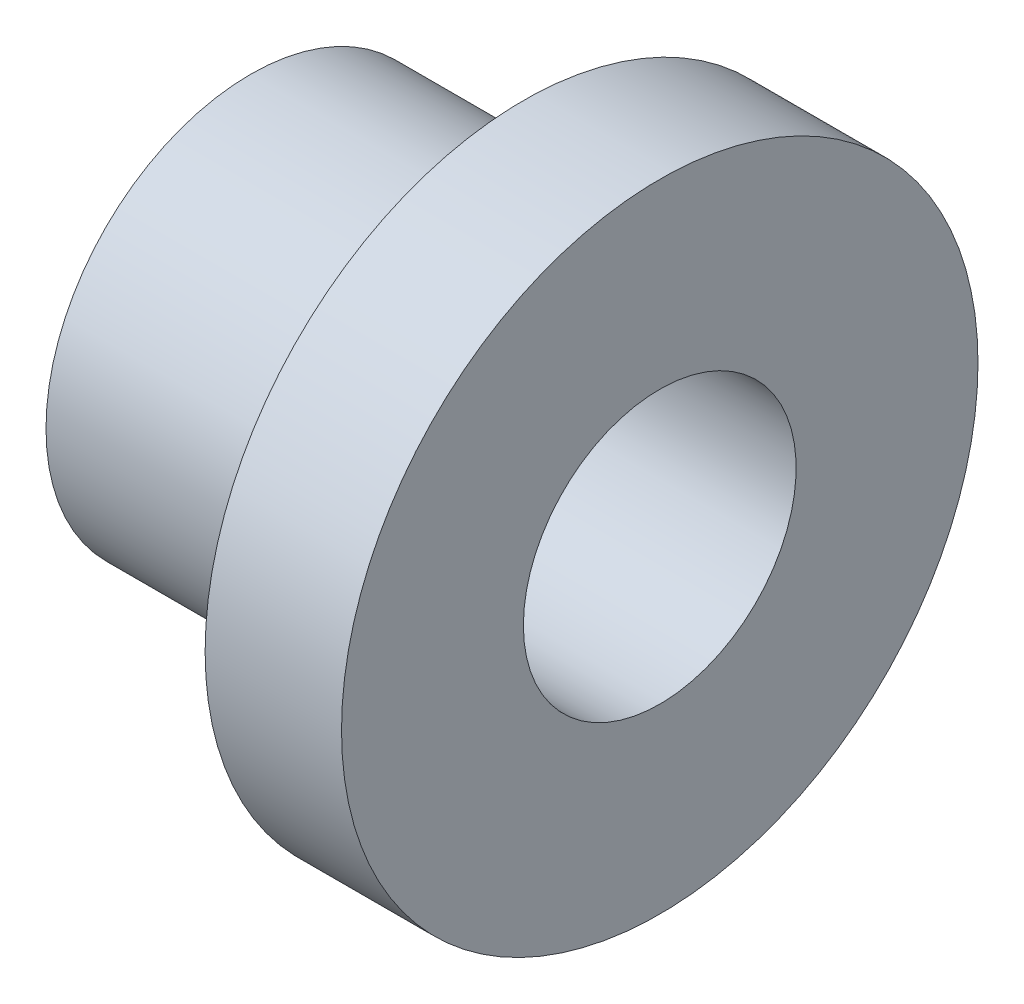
SolidWorks part; units mm, degrees
ref_plane "Plan de face" through (0, 0, 0) normal (0, 0, 1) x (1, 0, 0)
ref_plane "Plan de dessus" through (0, 0, 0) normal (0, 1, 0) x (1, 0, 0)
ref_plane "Plan de droite" through (0, 0, 0) normal (1, 0, 0) x (0, 0, -1)
sketch "Esquisse1" plane through (0, 0, 0) normal (0, 0, 1) x (1, 0, 0)
  line L0 (0, 0) -> (135.892, 0) construction
  line L1 (0, 4.5) -> (6, 4.5)
  line L2 (6, 4.5) -> (6, 7)
  line L3 (6, 7) -> (9, 7)
  line L4 (9, 7) -> (9, 3)
  line L5 (9, 3) -> (0, 3)
  line L6 (0, 3) -> (0, 4.5)
  dimension "D1" = 7
  dimension "D2" = 3
  dimension "D3" = 3
  dimension "D4" = 9
  dimension "D5" = 4.5
revolve "Révolution1" add sketch "Esquisse1" angle 360 about L0
